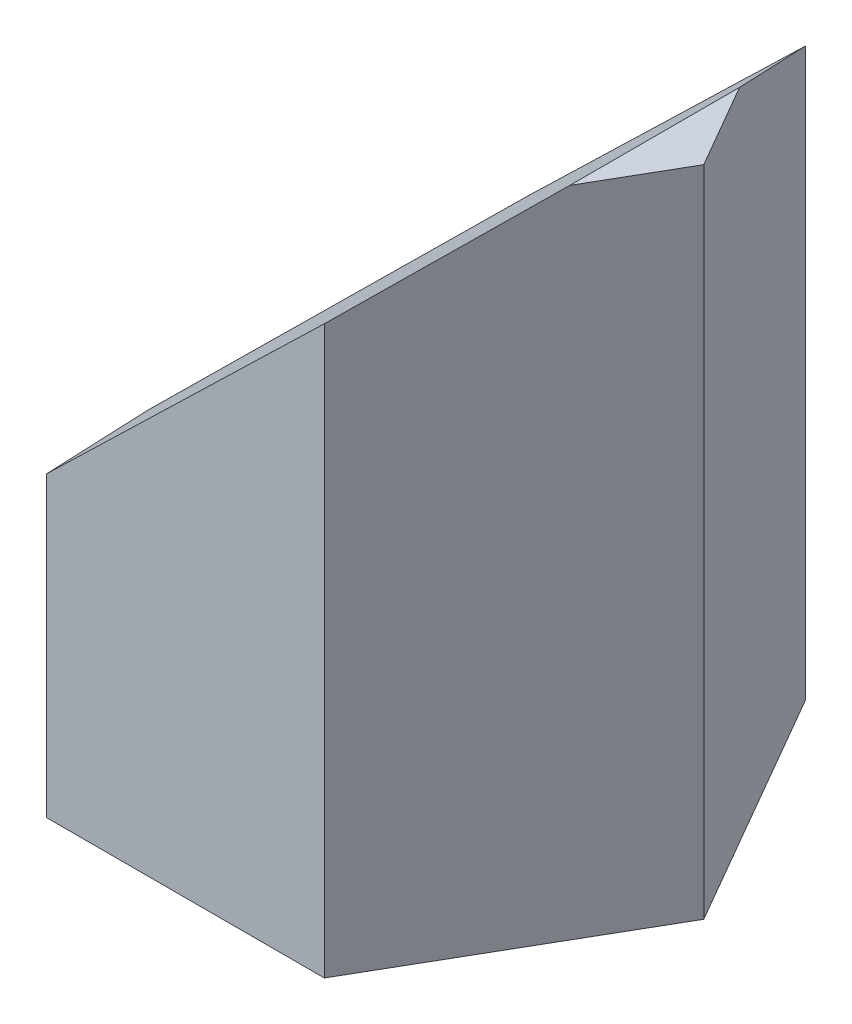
SolidWorks part; units mm, degrees
ref_plane "前视基准面" through (0, 0, 0) normal (0, 0, 1) x (1, 0, 0)
ref_plane "上视基准面" through (0, 0, 0) normal (0, 1, 0) x (1, 0, 0)
ref_plane "右视基准面" through (0, 0, 0) normal (1, 0, 0) x (0, 0, -1)
sketch "草图1" plane through (0, 0, 0) normal (0, 1, 0) x (1, 0, 0)
  line L0 (0, 0) -> (0, 29.2317) construction
  line L1 (17, 0) -> (8.5, 14.7224)
  line L2 (8.5, 14.7224) -> (-8.5, 14.7224)
  line L3 (-8.5, 14.7224) -> (-17, 0)
  line L4 (-17, 0) -> (-8.5, -14.7224)
  line L5 (-8.5, -14.7224) -> (8.5, -14.7224)
  line L6 (8.5, -14.7224) -> (17, 0)
  circle A0 centre (0, 0) radius 17 construction
  dimension "D1" = 34
  dimension "D2" = 90
extrude "凸台-拉伸1" add sketch "草图1" along normal blind 40
sketch "草图2" plane through (0, 0, 0) normal (0, 0, 1) x (1, 0, 0)
  line L0 (14, 40) -> (-17, 10)
  line L1 (8.5, 40) -> (17, 40) construction
  line L2 (-17, 40) -> (-17, 0) construction
  line L3 (-17, 10) -> (-17, 40)
  line L4 (-17, 40) -> (14, 40)
  dimension "D1" = 3
  dimension "D2" = 10
extrude "切除-拉伸1" cut sketch "草图2" against normal mid plane 40
